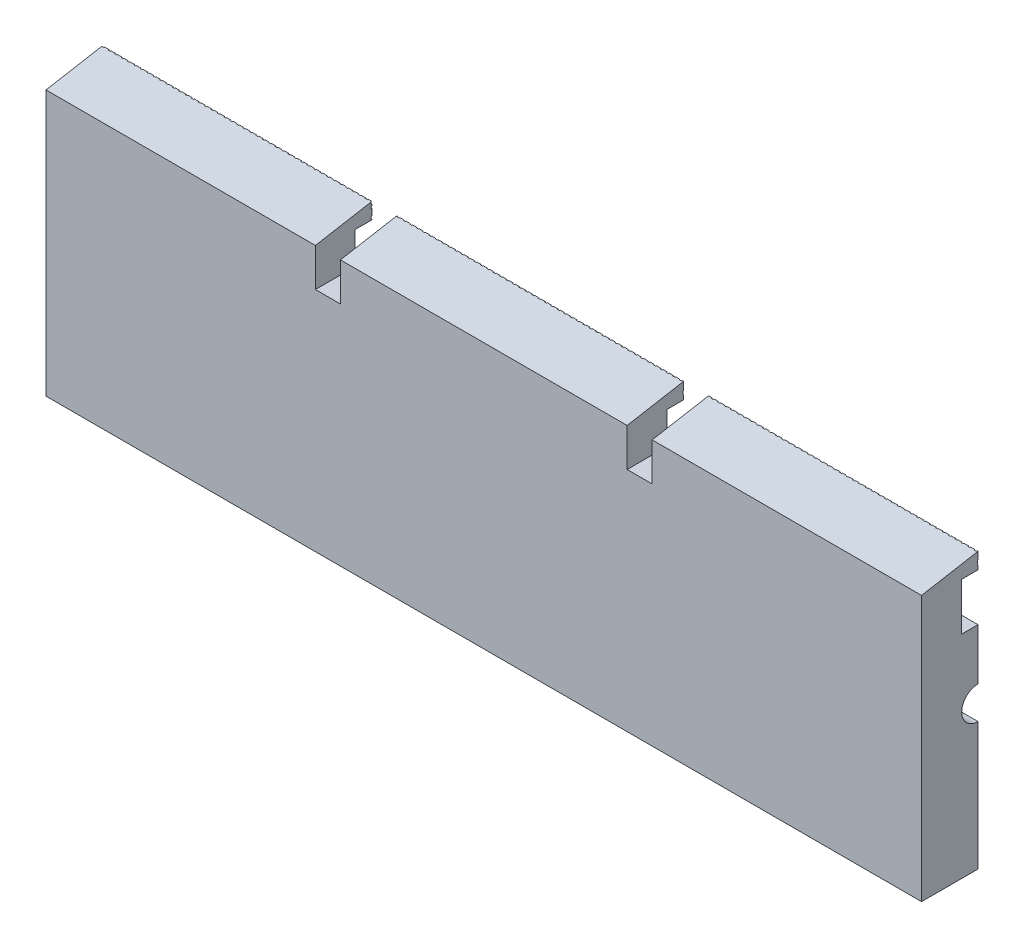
SolidWorks part; units mm, degrees
ref_plane "Plan de face" through (0, 0, 0) normal (0, 0, 1) x (1, 0, 0)
ref_plane "Plan de dessus" through (0, 0, 0) normal (0, 1, 0) x (1, 0, 0)
ref_plane "Plan de droite" through (0, 0, 0) normal (1, 0, 0) x (0, 0, -1)
sketch "Esquisse1" plane through (0, 0, 0) normal (0, 0, 1) x (1, 0, 0)
  line L1 (-68.25, 22.35) -> (68.25, 22.35)
  line L2 (-68.25, 22.35) -> (-68.25, -20.55)
  line L3 (-68.25, -20.55) -> (68.25, -20.55)
  line L4 (68.25, 22.35) -> (68.25, -20.55)
  dimension "D1" = 22.35
  dimension "D2" = 42.9
  dimension "D3" = 136.5
  dimension "D4" = 68.25
extrude "Matiere de depart" add sketch "Esquisse1" along normal blind 8.8
sketch "Esquisse2" plane through (68.25, 0, 0) normal (1, 0, 0) x (0, 0, -1)
  line L0 (0, -0.63) -> (0, 4.45)
  line L1 (0, 12.45) -> (0, 19.85)
  line L3 (0, 22.35) -> (0, 19.85)
  line L4 (0, -20.55) -> (0, 22.35) construction
  line L5 (0, 19.85) -> (-2.6, 19.85)
  line L6 (-2.6, 19.85) -> (-2.6, 12.45)
  line L7 (-2.6, 12.45) -> (0, 12.45)
  line L8 (0, 12.45) -> (0, 4.45)
  arc A0 (0, 4.45) -> (0, -0.63) centre (0, 1.91) ccw
  dimension "D1" = 2.5
  dimension "D3" = 7.4
  dimension "D4" = 5.08
  dimension "D5" = 2.6
  dimension "D6" = 8
extrude "Rainure" cut sketch "Esquisse2" against normal through all contours L6 L7 L5 M1 | A0 M1
chamfer "Chanfrein 8.80*10°" distance 8.8 angle 10 1 edges at (0, 22.35, 8.8)
sketch "Esquisse3" plane through (0, 0, 0) normal (0, 0, -1) x (-1, 0, 0)
  line L0 (-68.25, 22.35) -> (68.25, 22.35) construction
  line L1 (-26.25, 22.35) -> (-22.35, 22.35)
  line L2 (-26.25, 22.35) -> (-26.25, 14.85)
  line L3 (-26.25, 14.85) -> (-22.35, 14.85)
  line L4 (-22.35, 22.35) -> (-22.35, 14.85)
  line L5 (-68.25, 19.85) -> (-68.25, 12.45) construction
  line L6 (22.35, 22.35) -> (26.25, 22.35)
  line L7 (22.35, 22.35) -> (22.35, 14.85)
  line L8 (22.35, 14.85) -> (26.25, 14.85)
  line L9 (26.25, 22.35) -> (26.25, 14.85)
  line L10 (68.25, 19.85) -> (68.25, 12.45) construction
  dimension "D1" = 7.5
  dimension "D2" = 3.9
  dimension "D3" = 3.9
  dimension "D4" = 42
  dimension "D5" = 42
  dimension "D6" = 7.5
extrude "Rainure 2X3.90*7.5" cut sketch "Esquisse3" against normal through all
sketch "Esquisse8" plane through (0, 0, 0) normal (0, 0, -1) x (-1, 0, 0)
  line L0 (70.3908, 19.85) -> (67.8908, 22.35)
  line L1 (67.8908, 22.35) -> (68.25, 22.35)
  line L2 (68.25, 22.35) -> (70.75, 19.85)
  line L3 (70.75, 19.85) -> (70.3908, 19.85)
  line L4 (68.25, 19.85) -> (26.25, 19.85) construction
  line L5 (26.25, 22.35) -> (68.25, 22.35) construction
  line L6 (68.25, 22.35) -> (68.25, 19.85) construction
  line L7 (68.3908, 19.85) -> (65.8908, 22.35)
  line L8 (68.75, 19.85) -> (68.3908, 19.85)
  line L9 (66.25, 22.35) -> (68.75, 19.85)
  line L10 (65.8908, 22.35) -> (66.25, 22.35)
  line L11 (66.3908, 19.85) -> (63.8908, 22.35)
  line L12 (66.75, 19.85) -> (66.3908, 19.85)
  line L13 (64.25, 22.35) -> (66.75, 19.85)
  line L14 (63.8908, 22.35) -> (64.25, 22.35)
  line L15 (64.3908, 19.85) -> (61.8908, 22.35)
  line L16 (64.75, 19.85) -> (64.3908, 19.85)
  line L17 (62.25, 22.35) -> (64.75, 19.85)
  line L18 (61.8908, 22.35) -> (62.25, 22.35)
  line L19 (62.3908, 19.85) -> (59.8908, 22.35)
  line L20 (62.75, 19.85) -> (62.3908, 19.85)
  line L21 (60.25, 22.35) -> (62.75, 19.85)
  line L22 (59.8908, 22.35) -> (60.25, 22.35)
  line L23 (60.3908, 19.85) -> (57.8908, 22.35)
  line L24 (60.75, 19.85) -> (60.3908, 19.85)
  line L25 (58.25, 22.35) -> (60.75, 19.85)
  line L26 (57.8908, 22.35) -> (58.25, 22.35)
  line L27 (58.3908, 19.85) -> (55.8908, 22.35)
  line L28 (58.75, 19.85) -> (58.3908, 19.85)
  line L29 (56.25, 22.35) -> (58.75, 19.85)
  line L30 (55.8908, 22.35) -> (56.25, 22.35)
  line L31 (56.3908, 19.85) -> (53.8908, 22.35)
  line L32 (56.75, 19.85) -> (56.3908, 19.85)
  line L33 (54.25, 22.35) -> (56.75, 19.85)
  line L34 (53.8908, 22.35) -> (54.25, 22.35)
  line L35 (54.3908, 19.85) -> (51.8908, 22.35)
  line L36 (54.75, 19.85) -> (54.3908, 19.85)
  line L37 (52.25, 22.35) -> (54.75, 19.85)
  line L38 (51.8908, 22.35) -> (52.25, 22.35)
  line L39 (52.3908, 19.85) -> (49.8908, 22.35)
  line L40 (52.75, 19.85) -> (52.3908, 19.85)
  line L41 (50.25, 22.35) -> (52.75, 19.85)
  line L42 (49.8908, 22.35) -> (50.25, 22.35)
  line L43 (50.3908, 19.85) -> (47.8908, 22.35)
  line L44 (50.75, 19.85) -> (50.3908, 19.85)
  line L45 (48.25, 22.35) -> (50.75, 19.85)
  line L46 (47.8908, 22.35) -> (48.25, 22.35)
  line L47 (48.3908, 19.85) -> (45.8908, 22.35)
  line L48 (48.75, 19.85) -> (48.3908, 19.85)
  line L49 (46.25, 22.35) -> (48.75, 19.85)
  line L50 (45.8908, 22.35) -> (46.25, 22.35)
  line L51 (46.3908, 19.85) -> (43.8908, 22.35)
  line L52 (46.75, 19.85) -> (46.3908, 19.85)
  line L53 (44.25, 22.35) -> (46.75, 19.85)
  line L54 (43.8908, 22.35) -> (44.25, 22.35)
  line L55 (44.3908, 19.85) -> (41.8908, 22.35)
  line L56 (44.75, 19.85) -> (44.3908, 19.85)
  line L57 (42.25, 22.35) -> (44.75, 19.85)
  line L58 (41.8908, 22.35) -> (42.25, 22.35)
  line L59 (42.3908, 19.85) -> (39.8908, 22.35)
  line L60 (42.75, 19.85) -> (42.3908, 19.85)
  line L61 (40.25, 22.35) -> (42.75, 19.85)
  line L62 (39.8908, 22.35) -> (40.25, 22.35)
  line L63 (40.3908, 19.85) -> (37.8908, 22.35)
  line L64 (40.75, 19.85) -> (40.3908, 19.85)
  line L65 (38.25, 22.35) -> (40.75, 19.85)
  line L66 (37.8908, 22.35) -> (38.25, 22.35)
  line L67 (38.3908, 19.85) -> (35.8908, 22.35)
  line L68 (38.75, 19.85) -> (38.3908, 19.85)
  line L69 (36.25, 22.35) -> (38.75, 19.85)
  line L70 (35.8908, 22.35) -> (36.25, 22.35)
  line L71 (36.3908, 19.85) -> (33.8908, 22.35)
  line L72 (36.75, 19.85) -> (36.3908, 19.85)
  line L73 (34.25, 22.35) -> (36.75, 19.85)
  line L74 (33.8908, 22.35) -> (34.25, 22.35)
  line L75 (34.3908, 19.85) -> (31.8908, 22.35)
  line L76 (34.75, 19.85) -> (34.3908, 19.85)
  line L77 (32.25, 22.35) -> (34.75, 19.85)
  line L78 (31.8908, 22.35) -> (32.25, 22.35)
  line L79 (32.3908, 19.85) -> (29.8908, 22.35)
  line L80 (32.75, 19.85) -> (32.3908, 19.85)
  line L81 (30.25, 22.35) -> (32.75, 19.85)
  line L82 (29.8908, 22.35) -> (30.25, 22.35)
  line L83 (30.3908, 19.85) -> (27.8908, 22.35)
  line L84 (30.75, 19.85) -> (30.3908, 19.85)
  line L85 (28.25, 22.35) -> (30.75, 19.85)
  line L86 (27.8908, 22.35) -> (28.25, 22.35)
  line L87 (28.3908, 19.85) -> (25.8908, 22.35)
  line L88 (28.75, 19.85) -> (28.3908, 19.85)
  line L89 (26.25, 22.35) -> (28.75, 19.85)
  line L90 (25.8908, 22.35) -> (26.25, 22.35)
  line L91 (26.3908, 19.85) -> (23.8908, 22.35)
  line L92 (26.75, 19.85) -> (26.3908, 19.85)
  line L93 (24.25, 22.35) -> (26.75, 19.85)
  line L94 (23.8908, 22.35) -> (24.25, 22.35)
  line L95 (24.3908, 19.85) -> (21.8908, 22.35)
  line L96 (24.75, 19.85) -> (24.3908, 19.85)
  line L97 (22.25, 22.35) -> (24.75, 19.85)
  line L98 (21.8908, 22.35) -> (22.25, 22.35)
  line L99 (22.3908, 19.85) -> (19.8908, 22.35)
  line L100 (22.75, 19.85) -> (22.3908, 19.85)
  line L101 (20.25, 22.35) -> (22.75, 19.85)
  line L102 (19.8908, 22.35) -> (20.25, 22.35)
  line L103 (20.3908, 19.85) -> (17.8908, 22.35)
  line L104 (20.75, 19.85) -> (20.3908, 19.85)
  line L105 (18.25, 22.35) -> (20.75, 19.85)
  line L106 (17.8908, 22.35) -> (18.25, 22.35)
  line L107 (18.3908, 19.85) -> (15.8908, 22.35)
  line L108 (18.75, 19.85) -> (18.3908, 19.85)
  line L109 (16.25, 22.35) -> (18.75, 19.85)
  line L110 (15.8908, 22.35) -> (16.25, 22.35)
  line L111 (16.3908, 19.85) -> (13.8908, 22.35)
  line L112 (16.75, 19.85) -> (16.3908, 19.85)
  line L113 (14.25, 22.35) -> (16.75, 19.85)
  line L114 (13.8908, 22.35) -> (14.25, 22.35)
  line L115 (14.3908, 19.85) -> (11.8908, 22.35)
  line L116 (14.75, 19.85) -> (14.3908, 19.85)
  line L117 (12.25, 22.35) -> (14.75, 19.85)
  line L118 (11.8908, 22.35) -> (12.25, 22.35)
  line L119 (12.3908, 19.85) -> (9.8908, 22.35)
  line L120 (12.75, 19.85) -> (12.3908, 19.85)
  line L121 (10.25, 22.35) -> (12.75, 19.85)
  line L122 (9.8908, 22.35) -> (10.25, 22.35)
  line L123 (10.3908, 19.85) -> (7.8908, 22.35)
  line L124 (10.75, 19.85) -> (10.3908, 19.85)
  line L125 (8.25, 22.35) -> (10.75, 19.85)
  line L126 (7.8908, 22.35) -> (8.25, 22.35)
  line L127 (8.3908, 19.85) -> (5.8908, 22.35)
  line L128 (8.75, 19.85) -> (8.3908, 19.85)
  line L129 (6.25, 22.35) -> (8.75, 19.85)
  line L130 (5.8908, 22.35) -> (6.25, 22.35)
  line L131 (6.3908, 19.85) -> (3.8908, 22.35)
  line L132 (6.75, 19.85) -> (6.3908, 19.85)
  line L133 (4.25, 22.35) -> (6.75, 19.85)
  line L134 (3.8908, 22.35) -> (4.25, 22.35)
  line L135 (4.3908, 19.85) -> (1.8908, 22.35)
  line L136 (4.75, 19.85) -> (4.3908, 19.85)
  line L137 (2.25, 22.35) -> (4.75, 19.85)
  line L138 (1.8908, 22.35) -> (2.25, 22.35)
  line L139 (2.3908, 19.85) -> (-0.1092, 22.35)
  line L140 (2.75, 19.85) -> (2.3908, 19.85)
  line L141 (0.25, 22.35) -> (2.75, 19.85)
  line L142 (-0.1092, 22.35) -> (0.25, 22.35)
  line L143 (0.3908, 19.85) -> (-2.1092, 22.35)
  line L144 (0.75, 19.85) -> (0.3908, 19.85)
  line L145 (-1.75, 22.35) -> (0.75, 19.85)
  line L146 (-2.1092, 22.35) -> (-1.75, 22.35)
  line L147 (-1.6092, 19.85) -> (-4.1092, 22.35)
  line L148 (-1.25, 19.85) -> (-1.6092, 19.85)
  line L149 (-3.75, 22.35) -> (-1.25, 19.85)
  line L150 (-4.1092, 22.35) -> (-3.75, 22.35)
  line L151 (-3.6092, 19.85) -> (-6.1092, 22.35)
  line L152 (-3.25, 19.85) -> (-3.6092, 19.85)
  line L153 (-5.75, 22.35) -> (-3.25, 19.85)
  line L154 (-6.1092, 22.35) -> (-5.75, 22.35)
  line L155 (-5.6092, 19.85) -> (-8.1092, 22.35)
  line L156 (-5.25, 19.85) -> (-5.6092, 19.85)
  line L157 (-7.75, 22.35) -> (-5.25, 19.85)
  line L158 (-8.1092, 22.35) -> (-7.75, 22.35)
  line L159 (-7.6092, 19.85) -> (-10.1092, 22.35)
  line L160 (-7.25, 19.85) -> (-7.6092, 19.85)
  line L161 (-9.75, 22.35) -> (-7.25, 19.85)
  line L162 (-10.1092, 22.35) -> (-9.75, 22.35)
  line L163 (-9.6092, 19.85) -> (-12.1092, 22.35)
  line L164 (-9.25, 19.85) -> (-9.6092, 19.85)
  line L165 (-11.75, 22.35) -> (-9.25, 19.85)
  line L166 (-12.1092, 22.35) -> (-11.75, 22.35)
  line L167 (-11.6092, 19.85) -> (-14.1092, 22.35)
  line L168 (-11.25, 19.85) -> (-11.6092, 19.85)
  line L169 (-13.75, 22.35) -> (-11.25, 19.85)
  line L170 (-14.1092, 22.35) -> (-13.75, 22.35)
  line L171 (-13.6092, 19.85) -> (-16.1092, 22.35)
  line L172 (-13.25, 19.85) -> (-13.6092, 19.85)
  line L173 (-15.75, 22.35) -> (-13.25, 19.85)
  line L174 (-16.1092, 22.35) -> (-15.75, 22.35)
  line L175 (-15.6092, 19.85) -> (-18.1092, 22.35)
  line L176 (-15.25, 19.85) -> (-15.6092, 19.85)
  line L177 (-17.75, 22.35) -> (-15.25, 19.85)
  line L178 (-18.1092, 22.35) -> (-17.75, 22.35)
  line L179 (-17.6092, 19.85) -> (-20.1092, 22.35)
  line L180 (-17.25, 19.85) -> (-17.6092, 19.85)
  line L181 (-19.75, 22.35) -> (-17.25, 19.85)
  line L182 (-20.1092, 22.35) -> (-19.75, 22.35)
  line L183 (-19.6092, 19.85) -> (-22.1092, 22.35)
  line L184 (-19.25, 19.85) -> (-19.6092, 19.85)
  line L185 (-21.75, 22.35) -> (-19.25, 19.85)
  line L186 (-22.1092, 22.35) -> (-21.75, 22.35)
  line L187 (-21.6092, 19.85) -> (-24.1092, 22.35)
  line L188 (-21.25, 19.85) -> (-21.6092, 19.85)
  line L189 (-23.75, 22.35) -> (-21.25, 19.85)
  line L190 (-24.1092, 22.35) -> (-23.75, 22.35)
  line L191 (-23.6092, 19.85) -> (-26.1092, 22.35)
  line L192 (-23.25, 19.85) -> (-23.6092, 19.85)
  line L193 (-25.75, 22.35) -> (-23.25, 19.85)
  line L194 (-26.1092, 22.35) -> (-25.75, 22.35)
  line L195 (-25.6092, 19.85) -> (-28.1092, 22.35)
  line L196 (-25.25, 19.85) -> (-25.6092, 19.85)
  line L197 (-27.75, 22.35) -> (-25.25, 19.85)
  line L198 (-28.1092, 22.35) -> (-27.75, 22.35)
  line L199 (-27.6092, 19.85) -> (-30.1092, 22.35)
  line L200 (-27.25, 19.85) -> (-27.6092, 19.85)
  line L201 (-29.75, 22.35) -> (-27.25, 19.85)
  line L202 (-30.1092, 22.35) -> (-29.75, 22.35)
  line L203 (-29.6092, 19.85) -> (-32.1092, 22.35)
  line L204 (-29.25, 19.85) -> (-29.6092, 19.85)
  line L205 (-31.75, 22.35) -> (-29.25, 19.85)
  line L206 (-32.1092, 22.35) -> (-31.75, 22.35)
  line L207 (-31.6092, 19.85) -> (-34.1092, 22.35)
  line L208 (-31.25, 19.85) -> (-31.6092, 19.85)
  line L209 (-33.75, 22.35) -> (-31.25, 19.85)
  line L210 (-34.1092, 22.35) -> (-33.75, 22.35)
  line L211 (-33.6092, 19.85) -> (-36.1092, 22.35)
  line L212 (-33.25, 19.85) -> (-33.6092, 19.85)
  line L213 (-35.75, 22.35) -> (-33.25, 19.85)
  line L214 (-36.1092, 22.35) -> (-35.75, 22.35)
  line L215 (-35.6092, 19.85) -> (-38.1092, 22.35)
  line L216 (-35.25, 19.85) -> (-35.6092, 19.85)
  line L217 (-37.75, 22.35) -> (-35.25, 19.85)
  line L218 (-38.1092, 22.35) -> (-37.75, 22.35)
  line L219 (-37.6092, 19.85) -> (-40.1092, 22.35)
  line L220 (-37.25, 19.85) -> (-37.6092, 19.85)
  line L221 (-39.75, 22.35) -> (-37.25, 19.85)
  line L222 (-40.1092, 22.35) -> (-39.75, 22.35)
  line L223 (-39.6092, 19.85) -> (-42.1092, 22.35)
  line L224 (-39.25, 19.85) -> (-39.6092, 19.85)
  line L225 (-41.75, 22.35) -> (-39.25, 19.85)
  line L226 (-42.1092, 22.35) -> (-41.75, 22.35)
  line L227 (-41.6092, 19.85) -> (-44.1092, 22.35)
  line L228 (-41.25, 19.85) -> (-41.6092, 19.85)
  line L229 (-43.75, 22.35) -> (-41.25, 19.85)
  line L230 (-44.1092, 22.35) -> (-43.75, 22.35)
  line L231 (-43.6092, 19.85) -> (-46.1092, 22.35)
  line L232 (-43.25, 19.85) -> (-43.6092, 19.85)
  line L233 (-45.75, 22.35) -> (-43.25, 19.85)
  line L234 (-46.1092, 22.35) -> (-45.75, 22.35)
  line L235 (-45.6092, 19.85) -> (-48.1092, 22.35)
  line L236 (-45.25, 19.85) -> (-45.6092, 19.85)
  line L237 (-47.75, 22.35) -> (-45.25, 19.85)
  line L238 (-48.1092, 22.35) -> (-47.75, 22.35)
  line L239 (-47.6092, 19.85) -> (-50.1092, 22.35)
  line L240 (-47.25, 19.85) -> (-47.6092, 19.85)
  line L241 (-49.75, 22.35) -> (-47.25, 19.85)
  line L242 (-50.1092, 22.35) -> (-49.75, 22.35)
  line L243 (-49.6092, 19.85) -> (-52.1092, 22.35)
  line L244 (-49.25, 19.85) -> (-49.6092, 19.85)
  line L245 (-51.75, 22.35) -> (-49.25, 19.85)
  line L246 (-52.1092, 22.35) -> (-51.75, 22.35)
  line L247 (-51.6092, 19.85) -> (-54.1092, 22.35)
  line L248 (-51.25, 19.85) -> (-51.6092, 19.85)
  line L249 (-53.75, 22.35) -> (-51.25, 19.85)
  line L250 (-54.1092, 22.35) -> (-53.75, 22.35)
  line L251 (-53.6092, 19.85) -> (-56.1092, 22.35)
  line L252 (-53.25, 19.85) -> (-53.6092, 19.85)
  line L253 (-55.75, 22.35) -> (-53.25, 19.85)
  line L254 (-56.1092, 22.35) -> (-55.75, 22.35)
  line L255 (-55.6092, 19.85) -> (-58.1092, 22.35)
  line L256 (-55.25, 19.85) -> (-55.6092, 19.85)
  line L257 (-57.75, 22.35) -> (-55.25, 19.85)
  line L258 (-58.1092, 22.35) -> (-57.75, 22.35)
  line L259 (-57.6092, 19.85) -> (-60.1092, 22.35)
  line L260 (-57.25, 19.85) -> (-57.6092, 19.85)
  line L261 (-59.75, 22.35) -> (-57.25, 19.85)
  line L262 (-60.1092, 22.35) -> (-59.75, 22.35)
  line L263 (-59.6092, 19.85) -> (-62.1092, 22.35)
  line L264 (-59.25, 19.85) -> (-59.6092, 19.85)
  line L265 (-61.75, 22.35) -> (-59.25, 19.85)
  line L266 (-62.1092, 22.35) -> (-61.75, 22.35)
  line L267 (-61.6092, 19.85) -> (-64.1092, 22.35)
  line L268 (-61.25, 19.85) -> (-61.6092, 19.85)
  line L269 (-63.75, 22.35) -> (-61.25, 19.85)
  line L270 (-64.1092, 22.35) -> (-63.75, 22.35)
  line L271 (-63.6092, 19.85) -> (-66.1092, 22.35)
  line L272 (-63.25, 19.85) -> (-63.6092, 19.85)
  line L273 (-65.75, 22.35) -> (-63.25, 19.85)
  line L274 (-66.1092, 22.35) -> (-65.75, 22.35)
  line L275 (-65.6092, 19.85) -> (-68.1092, 22.35)
  line L276 (-65.25, 19.85) -> (-65.6092, 19.85)
  line L277 (-67.75, 22.35) -> (-65.25, 19.85)
  line L278 (-68.1092, 22.35) -> (-67.75, 22.35)
  line L279 (-67.6092, 19.85) -> (-70.1092, 22.35)
  line L280 (-67.25, 19.85) -> (-67.6092, 19.85)
  line L281 (-69.75, 22.35) -> (-67.25, 19.85)
  line L282 (-70.1092, 22.35) -> (-69.75, 22.35)
  line L283 (-69.6092, 19.85) -> (-72.1092, 22.35)
  line L284 (-69.25, 19.85) -> (-69.6092, 19.85)
  line L285 (-71.75, 22.35) -> (-69.25, 19.85)
  line L286 (-72.1092, 22.35) -> (-71.75, 22.35)
  dimension "D1" = 0.254
  dimension "D2" = 45
  dimension "D3" = 71
extrude "Enlèv. mat.-Extru.4" cut sketch "Esquisse8" against normal blind 0.1
sketch "Esquisse9" plane through (0, 0, 0) normal (0, 0, -1) x (-1, 0, 0)
  line L0 (-69.25, 19.85) -> (-66.75, 22.35)
  line L1 (-66.75, 22.35) -> (-67.1036, 22.35)
  line L2 (-67.1036, 22.35) -> (-69.6036, 19.85)
  line L3 (-69.6036, 19.85) -> (-69.25, 19.85)
  line L4 (-67.6092, 19.85) -> (-68.25, 19.85) construction
  line L5 (-67.75, 22.35) -> (-66.1092, 22.35) construction
  line L6 (-65.6092, 19.85) -> (-67.25, 19.85) construction
  line L7 (-67.25, 19.85) -> (-64.75, 22.35)
  line L8 (-64.75, 22.35) -> (-65.1036, 22.35)
  line L9 (-65.1036, 22.35) -> (-67.6036, 19.85)
  line L10 (-67.6036, 19.85) -> (-67.25, 19.85)
  line L11 (-65.25, 19.85) -> (-62.75, 22.35)
  line L12 (-62.75, 22.35) -> (-63.1036, 22.35)
  line L13 (-63.1036, 22.35) -> (-65.6036, 19.85)
  line L14 (-65.6036, 19.85) -> (-65.25, 19.85)
  line L15 (-63.25, 19.85) -> (-60.75, 22.35)
  line L16 (-60.75, 22.35) -> (-61.1036, 22.35)
  line L17 (-61.1036, 22.35) -> (-63.6036, 19.85)
  line L18 (-63.6036, 19.85) -> (-63.25, 19.85)
  line L19 (-61.25, 19.85) -> (-58.75, 22.35)
  line L20 (-58.75, 22.35) -> (-59.1036, 22.35)
  line L21 (-59.1036, 22.35) -> (-61.6036, 19.85)
  line L22 (-61.6036, 19.85) -> (-61.25, 19.85)
  line L23 (-59.25, 19.85) -> (-56.75, 22.35)
  line L24 (-56.75, 22.35) -> (-57.1036, 22.35)
  line L25 (-57.1036, 22.35) -> (-59.6036, 19.85)
  line L26 (-59.6036, 19.85) -> (-59.25, 19.85)
  line L27 (-57.25, 19.85) -> (-54.75, 22.35)
  line L28 (-54.75, 22.35) -> (-55.1036, 22.35)
  line L29 (-55.1036, 22.35) -> (-57.6036, 19.85)
  line L30 (-57.6036, 19.85) -> (-57.25, 19.85)
  line L31 (-55.25, 19.85) -> (-52.75, 22.35)
  line L32 (-52.75, 22.35) -> (-53.1036, 22.35)
  line L33 (-53.1036, 22.35) -> (-55.6036, 19.85)
  line L34 (-55.6036, 19.85) -> (-55.25, 19.85)
  line L35 (-53.25, 19.85) -> (-50.75, 22.35)
  line L36 (-50.75, 22.35) -> (-51.1036, 22.35)
  line L37 (-51.1036, 22.35) -> (-53.6036, 19.85)
  line L38 (-53.6036, 19.85) -> (-53.25, 19.85)
  line L39 (-51.25, 19.85) -> (-48.75, 22.35)
  line L40 (-48.75, 22.35) -> (-49.1036, 22.35)
  line L41 (-49.1036, 22.35) -> (-51.6036, 19.85)
  line L42 (-51.6036, 19.85) -> (-51.25, 19.85)
  line L43 (-49.25, 19.85) -> (-46.75, 22.35)
  line L44 (-46.75, 22.35) -> (-47.1036, 22.35)
  line L45 (-47.1036, 22.35) -> (-49.6036, 19.85)
  line L46 (-49.6036, 19.85) -> (-49.25, 19.85)
  line L47 (-47.25, 19.85) -> (-44.75, 22.35)
  line L48 (-44.75, 22.35) -> (-45.1036, 22.35)
  line L49 (-45.1036, 22.35) -> (-47.6036, 19.85)
  line L50 (-47.6036, 19.85) -> (-47.25, 19.85)
  line L51 (-45.25, 19.85) -> (-42.75, 22.35)
  line L52 (-42.75, 22.35) -> (-43.1036, 22.35)
  line L53 (-43.1036, 22.35) -> (-45.6036, 19.85)
  line L54 (-45.6036, 19.85) -> (-45.25, 19.85)
  line L55 (-43.25, 19.85) -> (-40.75, 22.35)
  line L56 (-40.75, 22.35) -> (-41.1036, 22.35)
  line L57 (-41.1036, 22.35) -> (-43.6036, 19.85)
  line L58 (-43.6036, 19.85) -> (-43.25, 19.85)
  line L59 (-41.25, 19.85) -> (-38.75, 22.35)
  line L60 (-38.75, 22.35) -> (-39.1036, 22.35)
  line L61 (-39.1036, 22.35) -> (-41.6036, 19.85)
  line L62 (-41.6036, 19.85) -> (-41.25, 19.85)
  line L63 (-39.25, 19.85) -> (-36.75, 22.35)
  line L64 (-36.75, 22.35) -> (-37.1036, 22.35)
  line L65 (-37.1036, 22.35) -> (-39.6036, 19.85)
  line L66 (-39.6036, 19.85) -> (-39.25, 19.85)
  line L67 (-37.25, 19.85) -> (-34.75, 22.35)
  line L68 (-34.75, 22.35) -> (-35.1036, 22.35)
  line L69 (-35.1036, 22.35) -> (-37.6036, 19.85)
  line L70 (-37.6036, 19.85) -> (-37.25, 19.85)
  line L71 (-35.25, 19.85) -> (-32.75, 22.35)
  line L72 (-32.75, 22.35) -> (-33.1036, 22.35)
  line L73 (-33.1036, 22.35) -> (-35.6036, 19.85)
  line L74 (-35.6036, 19.85) -> (-35.25, 19.85)
  line L75 (-33.25, 19.85) -> (-30.75, 22.35)
  line L76 (-30.75, 22.35) -> (-31.1036, 22.35)
  line L77 (-31.1036, 22.35) -> (-33.6036, 19.85)
  line L78 (-33.6036, 19.85) -> (-33.25, 19.85)
  line L79 (-31.25, 19.85) -> (-28.75, 22.35)
  line L80 (-28.75, 22.35) -> (-29.1036, 22.35)
  line L81 (-29.1036, 22.35) -> (-31.6036, 19.85)
  line L82 (-31.6036, 19.85) -> (-31.25, 19.85)
  line L83 (-29.25, 19.85) -> (-26.75, 22.35)
  line L84 (-26.75, 22.35) -> (-27.1036, 22.35)
  line L85 (-27.1036, 22.35) -> (-29.6036, 19.85)
  line L86 (-29.6036, 19.85) -> (-29.25, 19.85)
  line L87 (-27.25, 19.85) -> (-24.75, 22.35)
  line L88 (-24.75, 22.35) -> (-25.1036, 22.35)
  line L89 (-25.1036, 22.35) -> (-27.6036, 19.85)
  line L90 (-27.6036, 19.85) -> (-27.25, 19.85)
  line L91 (-25.25, 19.85) -> (-22.75, 22.35)
  line L92 (-22.75, 22.35) -> (-23.1036, 22.35)
  line L93 (-23.1036, 22.35) -> (-25.6036, 19.85)
  line L94 (-25.6036, 19.85) -> (-25.25, 19.85)
  line L95 (-23.25, 19.85) -> (-20.75, 22.35)
  line L96 (-20.75, 22.35) -> (-21.1036, 22.35)
  line L97 (-21.1036, 22.35) -> (-23.6036, 19.85)
  line L98 (-23.6036, 19.85) -> (-23.25, 19.85)
  line L99 (-21.25, 19.85) -> (-18.75, 22.35)
  line L100 (-18.75, 22.35) -> (-19.1036, 22.35)
  line L101 (-19.1036, 22.35) -> (-21.6036, 19.85)
  line L102 (-21.6036, 19.85) -> (-21.25, 19.85)
  line L103 (-19.25, 19.85) -> (-16.75, 22.35)
  line L104 (-16.75, 22.35) -> (-17.1036, 22.35)
  line L105 (-17.1036, 22.35) -> (-19.6036, 19.85)
  line L106 (-19.6036, 19.85) -> (-19.25, 19.85)
  line L107 (-17.25, 19.85) -> (-14.75, 22.35)
  line L108 (-14.75, 22.35) -> (-15.1036, 22.35)
  line L109 (-15.1036, 22.35) -> (-17.6036, 19.85)
  line L110 (-17.6036, 19.85) -> (-17.25, 19.85)
  line L111 (-15.25, 19.85) -> (-12.75, 22.35)
  line L112 (-12.75, 22.35) -> (-13.1036, 22.35)
  line L113 (-13.1036, 22.35) -> (-15.6036, 19.85)
  line L114 (-15.6036, 19.85) -> (-15.25, 19.85)
  line L115 (-13.25, 19.85) -> (-10.75, 22.35)
  line L116 (-10.75, 22.35) -> (-11.1036, 22.35)
  line L117 (-11.1036, 22.35) -> (-13.6036, 19.85)
  line L118 (-13.6036, 19.85) -> (-13.25, 19.85)
  line L119 (-11.25, 19.85) -> (-8.75, 22.35)
  line L120 (-8.75, 22.35) -> (-9.1036, 22.35)
  line L121 (-9.1036, 22.35) -> (-11.6036, 19.85)
  line L122 (-11.6036, 19.85) -> (-11.25, 19.85)
  line L123 (-9.25, 19.85) -> (-6.75, 22.35)
  line L124 (-6.75, 22.35) -> (-7.1036, 22.35)
  line L125 (-7.1036, 22.35) -> (-9.6036, 19.85)
  line L126 (-9.6036, 19.85) -> (-9.25, 19.85)
  line L127 (-7.25, 19.85) -> (-4.75, 22.35)
  line L128 (-4.75, 22.35) -> (-5.1036, 22.35)
  line L129 (-5.1036, 22.35) -> (-7.6036, 19.85)
  line L130 (-7.6036, 19.85) -> (-7.25, 19.85)
  line L131 (-5.25, 19.85) -> (-2.75, 22.35)
  line L132 (-2.75, 22.35) -> (-3.1036, 22.35)
  line L133 (-3.1036, 22.35) -> (-5.6036, 19.85)
  line L134 (-5.6036, 19.85) -> (-5.25, 19.85)
  line L135 (-3.25, 19.85) -> (-0.75, 22.35)
  line L136 (-0.75, 22.35) -> (-1.1036, 22.35)
  line L137 (-1.1036, 22.35) -> (-3.6036, 19.85)
  line L138 (-3.6036, 19.85) -> (-3.25, 19.85)
  line L139 (-1.25, 19.85) -> (1.25, 22.35)
  line L140 (1.25, 22.35) -> (0.8964, 22.35)
  line L141 (0.8964, 22.35) -> (-1.6036, 19.85)
  line L142 (-1.6036, 19.85) -> (-1.25, 19.85)
  line L143 (0.75, 19.85) -> (3.25, 22.35)
  line L144 (3.25, 22.35) -> (2.8964, 22.35)
  line L145 (2.8964, 22.35) -> (0.3964, 19.85)
  line L146 (0.3964, 19.85) -> (0.75, 19.85)
  line L147 (2.75, 19.85) -> (5.25, 22.35)
  line L148 (5.25, 22.35) -> (4.8964, 22.35)
  line L149 (4.8964, 22.35) -> (2.3964, 19.85)
  line L150 (2.3964, 19.85) -> (2.75, 19.85)
  line L151 (4.75, 19.85) -> (7.25, 22.35)
  line L152 (7.25, 22.35) -> (6.8964, 22.35)
  line L153 (6.8964, 22.35) -> (4.3964, 19.85)
  line L154 (4.3964, 19.85) -> (4.75, 19.85)
  line L155 (6.75, 19.85) -> (9.25, 22.35)
  line L156 (9.25, 22.35) -> (8.8964, 22.35)
  line L157 (8.8964, 22.35) -> (6.3964, 19.85)
  line L158 (6.3964, 19.85) -> (6.75, 19.85)
  line L159 (8.75, 19.85) -> (11.25, 22.35)
  line L160 (11.25, 22.35) -> (10.8964, 22.35)
  line L161 (10.8964, 22.35) -> (8.3964, 19.85)
  line L162 (8.3964, 19.85) -> (8.75, 19.85)
  line L163 (10.75, 19.85) -> (13.25, 22.35)
  line L164 (13.25, 22.35) -> (12.8964, 22.35)
  line L165 (12.8964, 22.35) -> (10.3964, 19.85)
  line L166 (10.3964, 19.85) -> (10.75, 19.85)
  line L167 (12.75, 19.85) -> (15.25, 22.35)
  line L168 (15.25, 22.35) -> (14.8964, 22.35)
  line L169 (14.8964, 22.35) -> (12.3964, 19.85)
  line L170 (12.3964, 19.85) -> (12.75, 19.85)
  line L171 (14.75, 19.85) -> (17.25, 22.35)
  line L172 (17.25, 22.35) -> (16.8964, 22.35)
  line L173 (16.8964, 22.35) -> (14.3964, 19.85)
  line L174 (14.3964, 19.85) -> (14.75, 19.85)
  line L175 (16.75, 19.85) -> (19.25, 22.35)
  line L176 (19.25, 22.35) -> (18.8964, 22.35)
  line L177 (18.8964, 22.35) -> (16.3964, 19.85)
  line L178 (16.3964, 19.85) -> (16.75, 19.85)
  line L179 (18.75, 19.85) -> (21.25, 22.35)
  line L180 (21.25, 22.35) -> (20.8964, 22.35)
  line L181 (20.8964, 22.35) -> (18.3964, 19.85)
  line L182 (18.3964, 19.85) -> (18.75, 19.85)
  line L183 (20.75, 19.85) -> (23.25, 22.35)
  line L184 (23.25, 22.35) -> (22.8964, 22.35)
  line L185 (22.8964, 22.35) -> (20.3964, 19.85)
  line L186 (20.3964, 19.85) -> (20.75, 19.85)
  line L187 (22.75, 19.85) -> (25.25, 22.35)
  line L188 (25.25, 22.35) -> (24.8964, 22.35)
  line L189 (24.8964, 22.35) -> (22.3964, 19.85)
  line L190 (22.3964, 19.85) -> (22.75, 19.85)
  line L191 (24.75, 19.85) -> (27.25, 22.35)
  line L192 (27.25, 22.35) -> (26.8964, 22.35)
  line L193 (26.8964, 22.35) -> (24.3964, 19.85)
  line L194 (24.3964, 19.85) -> (24.75, 19.85)
  line L195 (26.75, 19.85) -> (29.25, 22.35)
  line L196 (29.25, 22.35) -> (28.8964, 22.35)
  line L197 (28.8964, 22.35) -> (26.3964, 19.85)
  line L198 (26.3964, 19.85) -> (26.75, 19.85)
  line L199 (28.75, 19.85) -> (31.25, 22.35)
  line L200 (31.25, 22.35) -> (30.8964, 22.35)
  line L201 (30.8964, 22.35) -> (28.3964, 19.85)
  line L202 (28.3964, 19.85) -> (28.75, 19.85)
  line L203 (30.75, 19.85) -> (33.25, 22.35)
  line L204 (33.25, 22.35) -> (32.8964, 22.35)
  line L205 (32.8964, 22.35) -> (30.3964, 19.85)
  line L206 (30.3964, 19.85) -> (30.75, 19.85)
  line L207 (32.75, 19.85) -> (35.25, 22.35)
  line L208 (35.25, 22.35) -> (34.8964, 22.35)
  line L209 (34.8964, 22.35) -> (32.3964, 19.85)
  line L210 (32.3964, 19.85) -> (32.75, 19.85)
  line L211 (34.75, 19.85) -> (37.25, 22.35)
  line L212 (37.25, 22.35) -> (36.8964, 22.35)
  line L213 (36.8964, 22.35) -> (34.3964, 19.85)
  line L214 (34.3964, 19.85) -> (34.75, 19.85)
  line L215 (36.75, 19.85) -> (39.25, 22.35)
  line L216 (39.25, 22.35) -> (38.8964, 22.35)
  line L217 (38.8964, 22.35) -> (36.3964, 19.85)
  line L218 (36.3964, 19.85) -> (36.75, 19.85)
  line L219 (38.75, 19.85) -> (41.25, 22.35)
  line L220 (41.25, 22.35) -> (40.8964, 22.35)
  line L221 (40.8964, 22.35) -> (38.3964, 19.85)
  line L222 (38.3964, 19.85) -> (38.75, 19.85)
  line L223 (40.75, 19.85) -> (43.25, 22.35)
  line L224 (43.25, 22.35) -> (42.8964, 22.35)
  line L225 (42.8964, 22.35) -> (40.3964, 19.85)
  line L226 (40.3964, 19.85) -> (40.75, 19.85)
  line L227 (42.75, 19.85) -> (45.25, 22.35)
  line L228 (45.25, 22.35) -> (44.8964, 22.35)
  line L229 (44.8964, 22.35) -> (42.3964, 19.85)
  line L230 (42.3964, 19.85) -> (42.75, 19.85)
  line L231 (44.75, 19.85) -> (47.25, 22.35)
  line L232 (47.25, 22.35) -> (46.8964, 22.35)
  line L233 (46.8964, 22.35) -> (44.3964, 19.85)
  line L234 (44.3964, 19.85) -> (44.75, 19.85)
  line L235 (46.75, 19.85) -> (49.25, 22.35)
  line L236 (49.25, 22.35) -> (48.8964, 22.35)
  line L237 (48.8964, 22.35) -> (46.3964, 19.85)
  line L238 (46.3964, 19.85) -> (46.75, 19.85)
  line L239 (48.75, 19.85) -> (51.25, 22.35)
  line L240 (51.25, 22.35) -> (50.8964, 22.35)
  line L241 (50.8964, 22.35) -> (48.3964, 19.85)
  line L242 (48.3964, 19.85) -> (48.75, 19.85)
  line L243 (50.75, 19.85) -> (53.25, 22.35)
  line L244 (53.25, 22.35) -> (52.8964, 22.35)
  line L245 (52.8964, 22.35) -> (50.3964, 19.85)
  line L246 (50.3964, 19.85) -> (50.75, 19.85)
  line L247 (52.75, 19.85) -> (55.25, 22.35)
  line L248 (55.25, 22.35) -> (54.8964, 22.35)
  line L249 (54.8964, 22.35) -> (52.3964, 19.85)
  line L250 (52.3964, 19.85) -> (52.75, 19.85)
  line L251 (54.75, 19.85) -> (57.25, 22.35)
  line L252 (57.25, 22.35) -> (56.8964, 22.35)
  line L253 (56.8964, 22.35) -> (54.3964, 19.85)
  line L254 (54.3964, 19.85) -> (54.75, 19.85)
  line L255 (56.75, 19.85) -> (59.25, 22.35)
  line L256 (59.25, 22.35) -> (58.8964, 22.35)
  line L257 (58.8964, 22.35) -> (56.3964, 19.85)
  line L258 (56.3964, 19.85) -> (56.75, 19.85)
  line L259 (58.75, 19.85) -> (61.25, 22.35)
  line L260 (61.25, 22.35) -> (60.8964, 22.35)
  line L261 (60.8964, 22.35) -> (58.3964, 19.85)
  line L262 (58.3964, 19.85) -> (58.75, 19.85)
  line L263 (60.75, 19.85) -> (63.25, 22.35)
  line L264 (63.25, 22.35) -> (62.8964, 22.35)
  line L265 (62.8964, 22.35) -> (60.3964, 19.85)
  line L266 (60.3964, 19.85) -> (60.75, 19.85)
  line L267 (62.75, 19.85) -> (65.25, 22.35)
  line L268 (65.25, 22.35) -> (64.8964, 22.35)
  line L269 (64.8964, 22.35) -> (62.3964, 19.85)
  line L270 (62.3964, 19.85) -> (62.75, 19.85)
  line L271 (64.75, 19.85) -> (67.25, 22.35)
  line L272 (67.25, 22.35) -> (66.8964, 22.35)
  line L273 (66.8964, 22.35) -> (64.3964, 19.85)
  line L274 (64.3964, 19.85) -> (64.75, 19.85)
  line L275 (66.75, 19.85) -> (69.25, 22.35)
  line L276 (69.25, 22.35) -> (68.8964, 22.35)
  line L277 (68.8964, 22.35) -> (66.3964, 19.85)
  line L278 (66.3964, 19.85) -> (66.75, 19.85)
  line L279 (-68.25, 19.85) -> (-68.25, 20.4908) construction
  dimension "D1" = 45
  dimension "D2" = 0.25
  dimension "D4" = 1
  dimension "D3" = 69
extrude "Enlèv. mat.-Extru.5" cut sketch "Esquisse9" against normal blind 0.1
